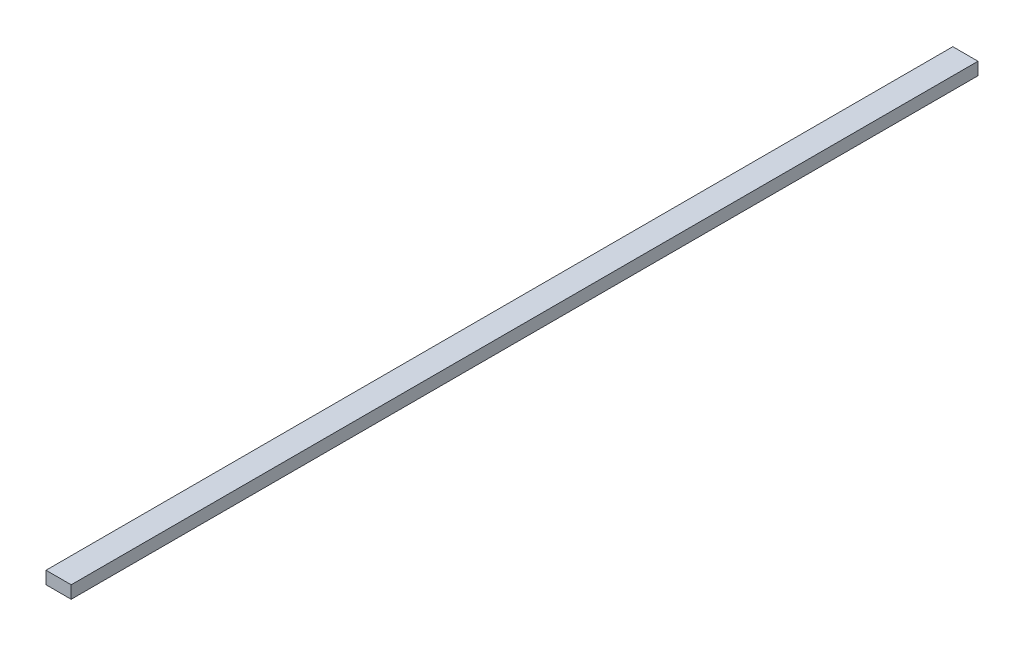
SolidWorks part; units mm, degrees
ref_plane "Front Plane" through (0, 0, 0) normal (0, 0, 1) x (1, 0, 0)
ref_plane "Top Plane" through (0, 0, 0) normal (0, 1, 0) x (1, 0, 0)
ref_plane "Right Plane" through (0, 0, 0) normal (1, 0, 0) x (0, 0, -1)
sketch "Sketch1" plane through (0, 0, 0) normal (0, 1, 0) x (1, 0, 0)
  line L0 (0, 0) -> (0, -3657.6)
  line L1 (0, -3657.6) -> (-101.6, -3657.6)
  line L2 (-101.6, -3657.6) -> (-101.6, 0)
  line L3 (-101.6, 0) -> (0, 0)
  dimension "D1" = 3657.6
  dimension "D2" = 101.6
  dimension "D3" = 101.6
extrude "Boss-Extrude1" add sketch "Sketch1" along normal blind 50.8
